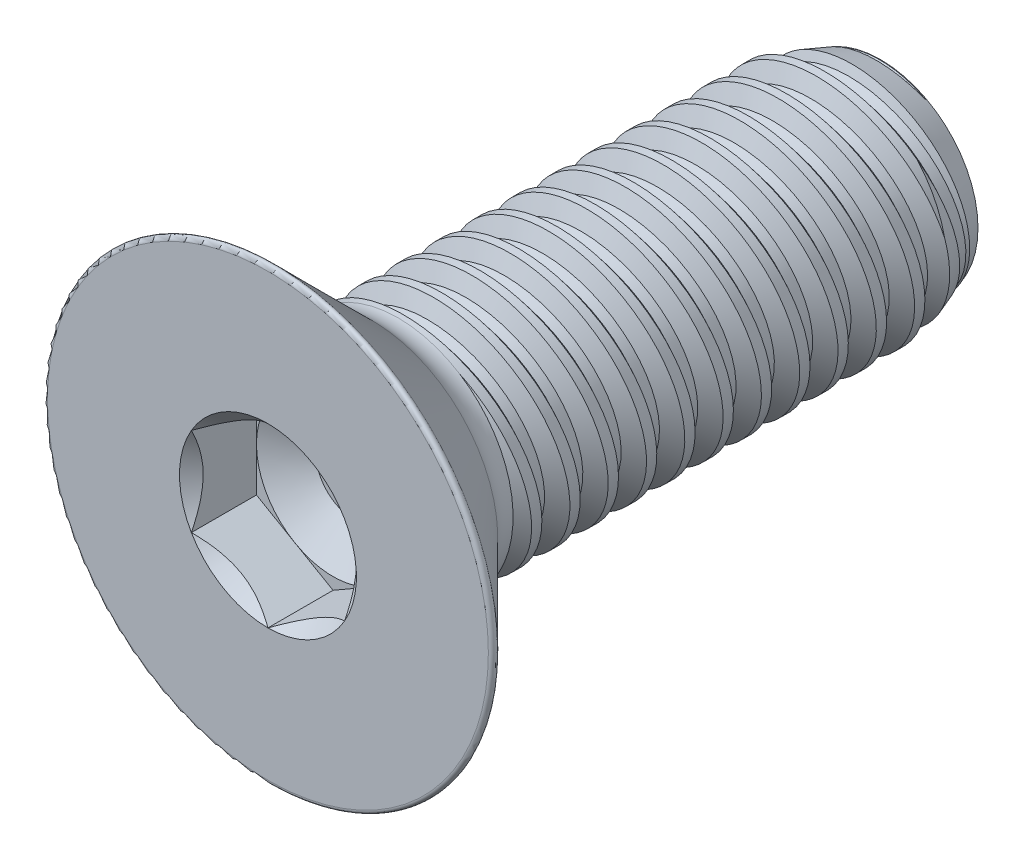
SolidWorks part; units mm, degrees
ref_plane "Front" through (0, 0, 0) normal (0, 0, 1) x (1, 0, 0)
ref_plane "Top" through (0, 0, 0) normal (0, 1, 0) x (1, 0, 0)
ref_plane "Right" through (0, 0, 0) normal (1, 0, 0) x (0, 0, -1)
sketch "Sketch1" plane through (0, 0, 0) normal (1, 0, 0) x (0, 0, -1)
  line L0 (0, 0) -> (-1.7, 0) construction
  line L1 (0, 0) -> (6.3, 0)
  line L2 (0, 0) -> (0, 1.5)
  line L3 (0, 1.5) -> (6.3, 1.5)
  line L4 (6.3, 0) -> (6.3, 1.5)
  line L5 (0, -1.5) -> (6.3, -1.5) construction
  dimension "Thread Dia" = 3
  dimension "Length" = 8
  dimension "Head Height" = 1.7
revolve "Revolve1" add sketch "Sketch1" angle 360 about L0
ref_plane "Plane1" through (0, 0, 1.7) normal (0, 0, 1) x (1, 0, 0)
sketch "Sketch2" plane through (0, 0, 0) normal (1, 0, 0) x (0, 0, -1)
  line L0 (0, 1.5) -> (0, -1.5) construction
  line L1 (0, -1.5) -> (0.5, -1.5) construction
  line L2 (0.5, -1.5) -> (0, 1.5) construction
  line L3 (0, 1.5) -> (0.0616, 1.5103) construction
  line L4 (0.0616, 1.5103) -> (0.4932, 1.5822)
  line L5 (0.4932, 1.5822) -> (0.3836, 1.2896)
  line L6 (0.3836, 1.2896) -> (0.2603, 1.269)
  line L7 (0.2603, 1.269) -> (0.0616, 1.5103)
  line L8 (0.3219, 1.2793) -> (0.2774, 1.5462) construction
  line L9 (0, -1.5) -> (6.3, -1.5) construction
  line L10 (0, 1.5) -> (6.3, 1.5) construction
  line L11 (6.3, 0) -> (6.3, 1.5) construction
  line L12 (0.2851, 1.5) -> (0.7851, -1.5) construction
  line L13 (0, -0.0892) -> (1.0703, 0.0892) construction
  line L15 (0, 0) -> (0, 1.5) construction
  point P19 (0.5351, 0)
  dimension "D1" = 60
  dimension "Thread Pitch" = 0.5
  dimension "D2" = 0.0625
  dimension "D3" = 0.125
  dimension "D4" = 0.5
  dimension "Min Thread Length" = 6.3
revolve "Cut-Revolve1" cut sketch "Sketch2" angle 360 about L13
sketch "Sketch3" plane through (0, 0, 0) normal (1, 0, 0) x (0, 0, -1)
  line L0 (6.3, 1.269) -> (5.6654, 1.5)
  line L1 (5.6654, 1.5) -> (6.3, 1.5)
  line L2 (6.3, 1.5) -> (6.3, 1.269)
  line L3 (0, 1.5) -> (6.3, 1.5) construction
  line L4 (6.3, 0) -> (6.3, 1.5) construction
  line L5 (5.6654, 0) -> (0, 0) construction
  line L6 (5.6654, 1.5) -> (5.6654, -1.5) construction
  line L7 (0, -1.5) -> (6.3, -1.5) construction
  dimension "D1" = 20
  dimension "D2" = 3
revolve "Cut-Revolve2" cut sketch "Sketch3" angle 360 about L5
pattern_linear "LPattern1" count 13 spacing 0.5 along (0, 0, 1)
pattern_linear "LPattern2" count 2 spacing 0.5 along (0, 0, 1)
sketch "Sketch4" plane through (0, 0, 0) normal (0, 0, 1) x (1, 0, 0)
  circle A0 centre (0, 0) radius 3
  dimension "Head Dia" = 6
extrude "Extrude1" add sketch "Sketch4" along normal up to surface (1.7 mm away)
sketch "Sketch9" plane through (0, 0, 0) normal (1, 0, 0) x (0, 0, -1)
  line L0 (-1.7, 3) -> (0, 1.3)
  line L1 (0, 1.3) -> (0, 3)
  line L2 (0, 3) -> (-1.7, 3)
  line L3 (0, 0) -> (-1.7, 0) construction
  line L6 (-1.7, -3) -> (0, -1.3) construction
  line L7 (0, -3) -> (0, 3) construction
  line L8 (-1.7, 3) -> (-1.7, -3) construction
  line L9 (0, 3) -> (-1.7, 3) construction
  dimension "D1" = 90
revolve "Cut-Revolve3" cut sketch "Sketch9" angle 360 about L3
fillet "Fillet1" radius 0.0508
sketch "Sketch6" plane through (0, 0, 1.7) normal (0, 0, 1) x (1, 0, 0)
  line L1 (0, -1.1547) -> (1, -0.5774)
  line L2 (1, -0.5774) -> (1, 0.5774)
  line L3 (1, 0.5774) -> (0, 1.1547)
  line L4 (0, 1.1547) -> (-1, 0.5774)
  line L5 (-1, 0.5774) -> (-1, -0.5774)
  line L6 (-1, -0.5774) -> (0, -1.1547)
  circle A0 centre (0, 0) radius 1 construction
  dimension "Hex" = 2
extrude "Cut-Extrude1" cut sketch "Sketch6" against normal blind 0.85
sketch "Sketch7" plane through (0, 0, 1.7) normal (0, 0, 1) x (1, 0, 0)
  circle A0 centre (0, 0) radius 1.1547
extrude "Cut-Extrude4" cut sketch "Sketch7" against normal blind 0.85 draft 45
sketch "Sketch8" plane through (0, 0, 0.85) normal (0, 0, 1) x (1, 0, 0)
  circle A0 centre (0, 0) radius 1 construction
  circle A1 centre (0, 0) radius 1
extrude "Cut-Extrude5" cut sketch "Sketch8" against normal blind 0.2833 draft 60
sketch "Sketch12" plane through (0, 0, 0) normal (1, 0, 0) x (0, 0, -1)
  line L0 (0, 1.5) -> (0, 1.3)
  line L1 (0, 1.3) -> (-0.3414, 1.6414)
  line L2 (0, 1.3) -> (0, 3) construction
  line L3 (-1.7, 3) -> (0, 1.3) construction
  line L4 (0, 1.5) -> (6.3, 1.5) construction
  line L5 (0, 0) -> (-0.3414, 0) construction
  line L6 (0, 0) -> (-1.7, 0) construction
  arc A0 (-0.3414, 1.6414) -> (0, 1.5) centre (0, 1.9828) ccw
revolve "Revolve2" add sketch "Sketch12" angle 360 about L5
equation "\"D2@Sketch2\"=\"Thread Pitch@Sketch2\"/8"
equation "\"D3@Sketch2\"=\"Thread Pitch@Sketch2\"/4"
equation "\"D4@Sketch2\"=\"Thread Pitch@Sketch2\""
equation "\"D3@LPattern1\"=\"Thread Pitch@Sketch2\""
equation "\"D1@LPattern1\"=\"Min Thread Length@Sketch2\"/\"Thread Pitch@Sketch2\""
equation "\"D1@Cut-Extrude1\"=\"Head Height@Sketch1\"/2"
equation "\"D1@Cut-Extrude4\"=\"D1@Cut-Extrude1\""
equation "\"D1@Cut-Extrude5\"=\"D1@Cut-Extrude1\"/3"
equation "\"D3@LPattern2\"=\"Thread Pitch@Sketch2\""
